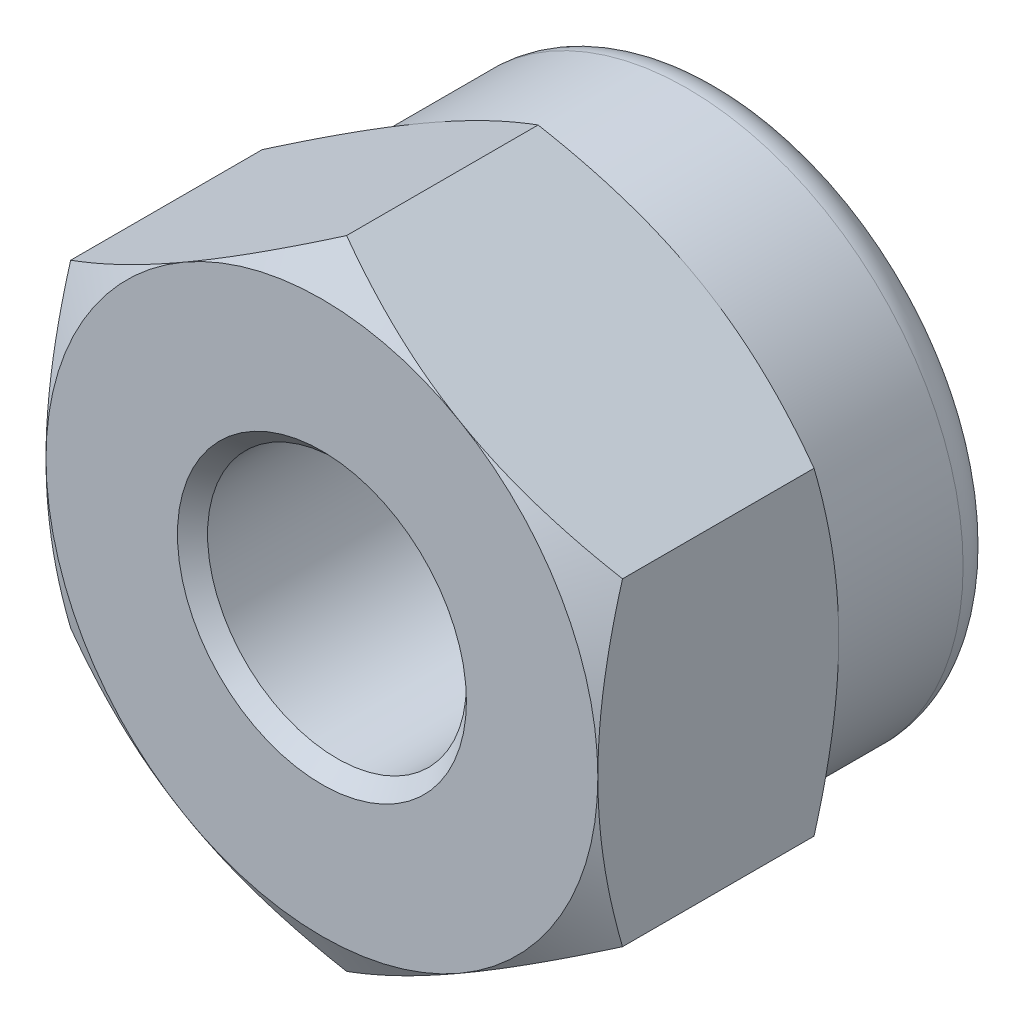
SolidWorks part; units mm, degrees
ref_plane "前视基准面" through (0, 0, 0) normal (0, 0, 1) x (1, 0, 0)
ref_plane "上视基准面" through (0, 0, 0) normal (0, 1, 0) x (1, 0, 0)
ref_plane "右视基准面" through (0, 0, 0) normal (1, 0, 0) x (0, 0, -1)
sketch "草图1" plane through (0, 0, 0) normal (0, 0, 1) x (1, 0, 0)
  line L1 (0, 0) -> (6.01, 0)
  line L2 (0, 0) -> (0, -3)
  line L3 (0, -3) -> (6.01, -3)
  line L4 (6.01, 0) -> (6.01, -3)
  line L5 (0, 0) -> (0.5, 0)
  line L6 (0, 0) -> (0, -2.4)
  line L7 (0, -2.4) -> (0.5, -2.4)
  line L8 (0.5, 0) -> (0.5, -2.4)
  line L9 (0, 0) -> (5.5, 0)
  line L10 (0, 0) -> (0, -4)
  line L11 (0, -4) -> (5.5, -4)
  line L12 (5.5, 0) -> (5.5, -4)
  dimension "E" = 6.01
  dimension "M" = 3
  dimension "M_" = 2.4
  dimension "P" = 0.5
  dimension "H" = 4
  dimension "S" = 5.5
sketch "草图7" plane through (0, 0, 0) normal (0, 0, 1) x (1, 0, 0)
  line L1 (0, 3.1754) -> (-2.75, 1.5877)
  line L2 (-2.75, 1.5877) -> (-2.75, -1.5877)
  line L3 (-2.75, -1.5877) -> (0, -3.1754)
  line L4 (0, -3.1754) -> (2.75, -1.5877)
  line L5 (2.75, -1.5877) -> (2.75, 1.5877)
  line L6 (2.75, 1.5877) -> (0, 3.1754)
  circle A0 centre (0, 0) radius 2.75 construction
  circle A1 centre (0, 0) radius 1.29
  dimension "D1" = 2.58
  dimension "D2" = 5.5
extrude "凸台-拉伸1" add sketch "草图7" against normal blind 2.4
sketch "草图2" plane through (0, 0, 0) normal (1, 0, 0) x (0, 0, -1)
  line L0 (0, 2.75) -> (0.2456, 3.1754)
  line L1 (0, 1.5877) -> (0, 3.1754) construction
  line L2 (2.4, 3.1754) -> (0, 3.1754) construction
  line L3 (0.2456, 3.1754) -> (0, 3.1754)
  line L4 (0, 3.1754) -> (0, 2.75)
  line L5 (0, 0) -> (2.4, 0) construction
  line L6 (2.4, -1.5877) -> (2.4, 1.5877) construction
  line L7 (2.4, 2.75) -> (2.1544, 3.1754)
  line L8 (2.4, 1.5877) -> (2.4, 3.1754) construction
  line L9 (2.1544, 3.1754) -> (2.4, 3.1754)
  line L10 (2.4, 3.1754) -> (2.4, 2.75)
  dimension "D1" = 5.5
  dimension "D2" = 30
revolve "切除-旋转1" cut sketch "草图2" angle 360 about L5
chamfer "倒角1" [suppressed] distance 0.15 angle 45
sketch "草图3" [suppressed] plane through (0, 0, 0) normal (0, 0, 1) x (1, 0, 0)
  circle A0 centre (0, 0) radius 2.4
  circle A1 centre (0, 0) radius 3.5
  dimension "D1" = 3.6
extrude "凸台-拉伸2" [suppressed] add sketch "草图3" along normal blind 1.6
fillet "圆角1" [suppressed] radius 0.15
sketch "草图4" [suppressed] plane through (0, 0, 0) normal (0, 0, 1) x (1, 0, 0)
  line L0 (-1.72, 0) -> (-1.9596, 0)
  line L1 (-0.86, 1.4896) -> (-0.9798, 1.6971)
  arc A0 (-1.9596, 0) -> (-2.3515, 0.48) centre (-1.9596, 0.4) cw
  arc A1 (-1.5914, 1.7965) -> (-0.9798, 1.6971) centre (-1.3262, 1.4971) cw
  circle A3 centre (0, 0) radius 2.4 construction
  arc A4 (-1.5914, 1.7965) -> (-2.3515, 0.48) centre (0, 0) ccw
  arc A5 (-0.86, 1.4896) -> (-1.72, 0) centre (0, 0) ccw
  point P4 (-2.4, 0)
  dimension "D1" = 2.58
  dimension "D3" = 0.3
  dimension "D2" = 60
extrude "凸台-拉伸3" [suppressed] add sketch "草图4" along normal blind 0.8
pattern_circular "阵列(圆周)1" [suppressed] count 3 over 360
sketch "草图5" plane through (0, 0, -2.4) normal (0, 0, -1) x (-1, 0, 0)
  circle A0 centre (0, 0) radius 2.75
  circle A2 centre (0, 0) radius 1.65
  dimension "D1" = 3.3
extrude "凸台-拉伸4" add sketch "草图5" along normal blind 1.6
fillet "圆角2" radius 0.36 1 edges at (-2.75, 0, -4)
sketch "草图6" plane through (0, 0, -4) normal (0, 0, -1) x (-1, 0, 0)
  circle A0 centre (0, 0) radius 2.0625
  dimension "D1" = 4.125
extrude "切除-拉伸1" cut sketch "草图6" against normal blind 0.4
fillet "圆角3" radius 0.075 1 edges at (-2.0625, 0, -4)
chamfer "倒角2" distance 0.15 angle 45 2 edges at (1.29, 0, 0) (1.29, 0, -2.4)
